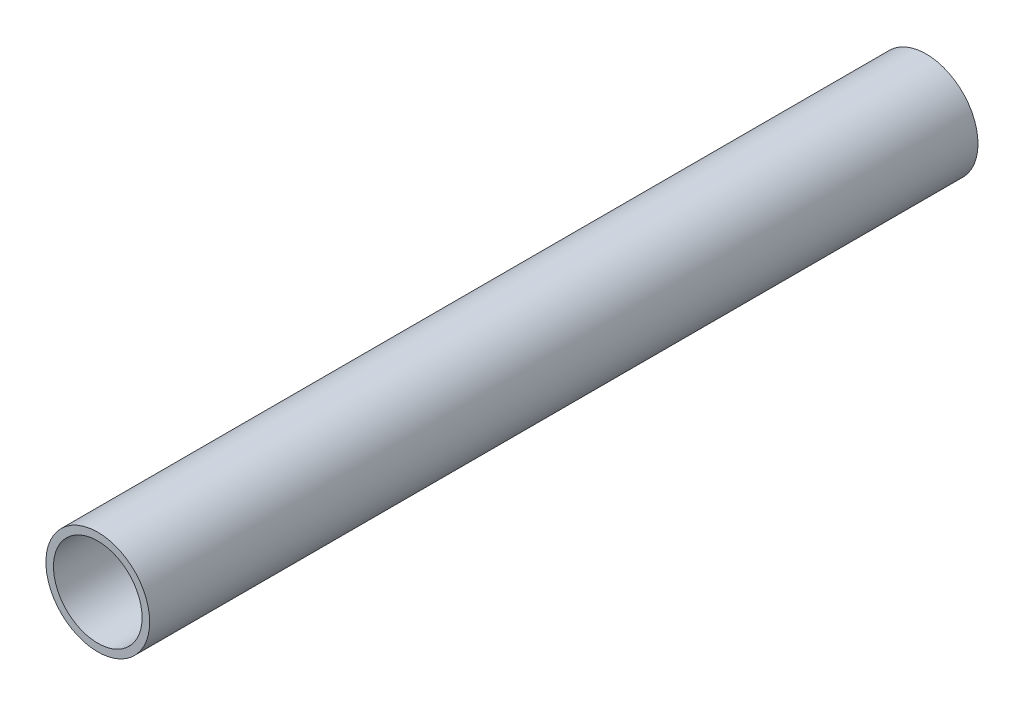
SolidWorks part; units mm, degrees
ref_plane "Plane1" through (0, 0, 0) normal (0, 0, 1) x (1, 0, 0)
ref_plane "Plane2" through (0, 0, 0) normal (0, 1, 0) x (1, 0, 0)
ref_plane "Plane3" through (0, 0, 0) normal (1, 0, 0) x (0, 0, -1)
sketch "Sketch1" plane through (0, 0, 0) normal (0, 0, 1) x (1, 0, 0)
  circle A0 centre (0, 0) radius 19.0881
  dimension "D1" = 38.1762
extrude "Base-Extrude" add sketch "Sketch1" along normal blind 1474.47
sketch "Sketch2" plane through (0, 0, 1474.47) normal (0, 0, 1) x (1, 0, 0)
  circle A0 centre (0, 0) radius 16.3016
  dimension "D1" = 32.6033
extrude "Cut-Extrude1" cut sketch "Sketch2" against normal through all
ref_plane "Plane4" through (0, 0, 609.6) normal (0, 0, 1) x (1, 0, 0)
sketch "Sketch3" plane through (0, 0, 609.6) normal (0, 0, 1) x (1, 0, 0)
  circle A0 centre (0, 0) radius 25.4
  dimension "D1" = 50.8
extrude "Cut-Extrude2" cut sketch "Sketch3" along normal through all
ref_plane "Plane5" through (0, 0, 304.8) normal (0, 0, 1) x (1, 0, 0)
sketch "Sketch4" plane through (0, 0, 304.8) normal (0, 0, 1) x (1, 0, 0)
  circle A0 centre (0, 0) radius 22.1309
extrude "Cut-Extrude3" cut sketch "Sketch4" against normal through all
